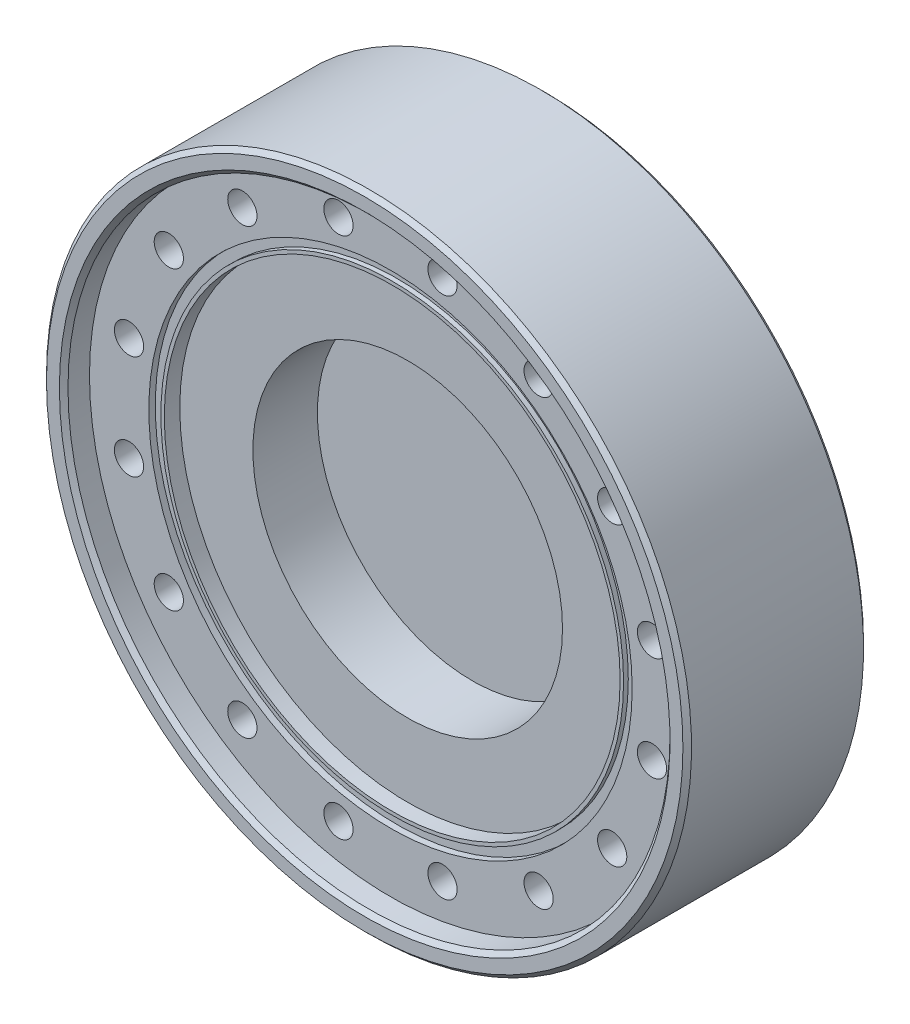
SolidWorks part; units mm, degrees
ref_plane "前视基准面" through (0, 0, 0) normal (0, 0, 1) x (1, 0, 0)
ref_plane "上视基准面" through (0, 0, 0) normal (0, 1, 0) x (1, 0, 0)
ref_plane "右视基准面" through (0, 0, 0) normal (1, 0, 0) x (0, 0, -1)
sketch "草图2" plane through (0, 0, 0) normal (1, 0, 0) x (0, 0, -1)
  line L0 (0, 0) -> (343.2577, 0) construction
  line L1 (3, 26.5) -> (5, 26.5)
  line L2 (0, 37.5) -> (21, 37.5)
  line L3 (21, 37.5) -> (21, 0)
  line L4 (5, 26.5) -> (5, 18)
  line L5 (12.5, 0) -> (21, 0)
  line L6 (0, 35) -> (3, 35)
  line L7 (3, 35) -> (3, 26.5)
  line L8 (0, 35) -> (0, 37.5)
  line L9 (5, 18) -> (12.5, 18)
  line L10 (12.5, 18) -> (12.5, 0)
  dimension "D1" = 75
  dimension "D2" = 2
  dimension "D3" = 3
  dimension "D4" = 7.5
  dimension "D5" = 18
  dimension "D7" = 36
  dimension "D8" = 53
  dimension "D9" = 70
revolve "旋转1" add sketch "草图2" angle 360 about L0
hole_wizard "M6 螺纹孔1" positions "草图4" profile "草图3" tap size "M6" standard "GB"
sketch "草图4" plane through (0, 0, -21) normal (0, 0, -1) x (-1, 0, 0)
  line L0 (0, 0) -> (0, 22.5) construction
  circle A0 centre (0, 0) radius 22.5 construction
  point P0 (0, 22.5)
  dimension "D1" = 45
sketch "草图3" plane through (0, 22.5, -21) normal (1, 0, 0) x (0, 1, 0)
  line L0 (0, 0) -> (0, 14.5022)
  line L1 (0, 14.5022) -> (2.5, 13)
  line L2 (2.5, 13) -> (2.5, 0)
  line L5 (2.5, 0) -> (0, 0)
  line L10 (0, 14.5022) -> (-2.5, 13) construction
  line L11 (0, -6.35) -> (0, 107.95) construction
  dimension "ÂÝÎÆ¿××êÍ·Ö±¾¶" = 5
  dimension "ÂÝÎÆ¿××êÍ·Éî¶È" = 13
  dimension "µ¼Í·½Ç¶È" = 118
pattern_circular "阵列(圆周)1" count 6 over 360 about axis through (0, 0, 0) along (0, 0, 1) of "M6 螺纹孔1"
hole_wizard "Ø4.0 (4) 直径孔1" positions "草图6" profile "草图5" hole size "Ø4.0" standard "GB"
sketch "草图6" plane through (0, 0, -21) normal (0, 0, -1) x (-1, 0, 0)
  line L0 (0, 0) -> (-22.5, 0) construction
  point P0 (-22.5, 0)
  dimension "D1" = 22.5
sketch "草图5" plane through (22.5, 0, -21) normal (1, 0, 0) x (0, 1, 0)
  line L0 (0, 0) -> (0, 7.2017)
  line L1 (0, 7.2017) -> (2, 6)
  line L2 (2, 6) -> (2, 0)
  line L5 (2, 0) -> (0, 0)
  line L10 (0, 7.2017) -> (-2, 6) construction
  line L11 (0, -6.35) -> (0, 107.95) construction
  dimension "¿×Ö±¾¶" = 4
  dimension "¿×Éî¶È" = 6
  dimension "µ¼Í·½Ç¶È" = 118
hole_wizard "打孔尺寸根据内六角圆柱头螺钉的类型1" positions "草图8" profile "草图7" counterbore size "M3" standard "GB"
sketch "草图8" plane through (0, 0, -21) normal (0, 0, -1) x (-1, 0, 0)
  line L0 (0, 0) -> (30.4043, 6.0478) construction
  line L1 (0, 0) -> (49.2438, 0) construction
  circle A0 centre (0, 0) radius 31 construction
  point P0 (30.4043, 6.0478)
  dimension "D1" = 62
  dimension "D2" = 11.25
sketch "草图7" plane through (-30.4043, 6.0478, -21) normal (1, 0, 0) x (0, 1, 0)
  line L0 (0, 0) -> (0, 21)
  line L1 (0, 21) -> (1.7, 21)
  line L3 (1.7, 21) -> (1.7, 4)
  line L4 (1.7, 4) -> (3, 4)
  line L5 (3, 4) -> (3, 0)
  line L7 (3, 0) -> (0, 0)
  line L11 (0, -6.35) -> (0, 107.95) construction
  dimension "Í¨¿×¿×Ö±¾¶" = 3.4
  dimension "Í¨¿×¿×Éî¶È" = 21
  dimension "ÖùÐÎ³ÁÍ·¿×Ö±¾¶" = 6
  dimension "ÖùÐÎ³ÁÍ·¿×Éî¶È" = 4
pattern_circular "阵列(圆周)2" count 16 over 360 about axis through (0, 0, 0) along (0, 0, 1) of "打孔尺寸根据内六角圆柱头螺钉的类型1"
sketch "草图9" plane through (0, 0, -21) normal (0, 0, -1) x (-1, 0, 0)
  line L0 (0, 0) -> (68, 0) construction
  line L1 (34, 3) -> (37.3798, 3)
  line L2 (34, -3) -> (37.3798, -3)
  arc A0 (34, 3) -> (34, -3) centre (34, 0) ccw
  circle A1 centre (0, 0) radius 37.5 construction
  arc A2 (37.3798, -3) -> (37.3798, 3) centre (0, 0) ccw
  dimension "D1" = 3
  dimension "D2" = 34
extrude "切除-拉伸1" cut sketch "草图9" against normal blind 10
sketch "草图10" plane through (0, 0, -3) normal (0, 0, 1) x (1, 0, 0)
  circle A0 centre (0, 0) radius 28.1
  circle A1 centre (0, 0) radius 26.9
  dimension "D1" = 53.8
  dimension "D2" = 56.2
extrude "切除-拉伸3" cut sketch "草图10" against normal blind 0.75
sketch "草图11" plane through (0, 0, -21) normal (0, 0, -1) x (-1, 0, 0)
  circle A0 centre (0, 0) radius 9
  dimension "D1" = 18
extrude "切除-拉伸4" cut sketch "草图11" against normal blind 6
sketch "草图12" plane through (0, 0, -3) normal (0, 0, 1) x (1, 0, 0)
  circle A0 centre (0, 0) radius 26.9
extrude "切除-拉伸5" cut sketch "草图12" against normal blind 0.2
chamfer "倒角1" distance 0.5 angle 45 4 edges at (35, 0, 0) (37.5, 0, 0) (37.5, 0, -21) (-9, 0, -21)
